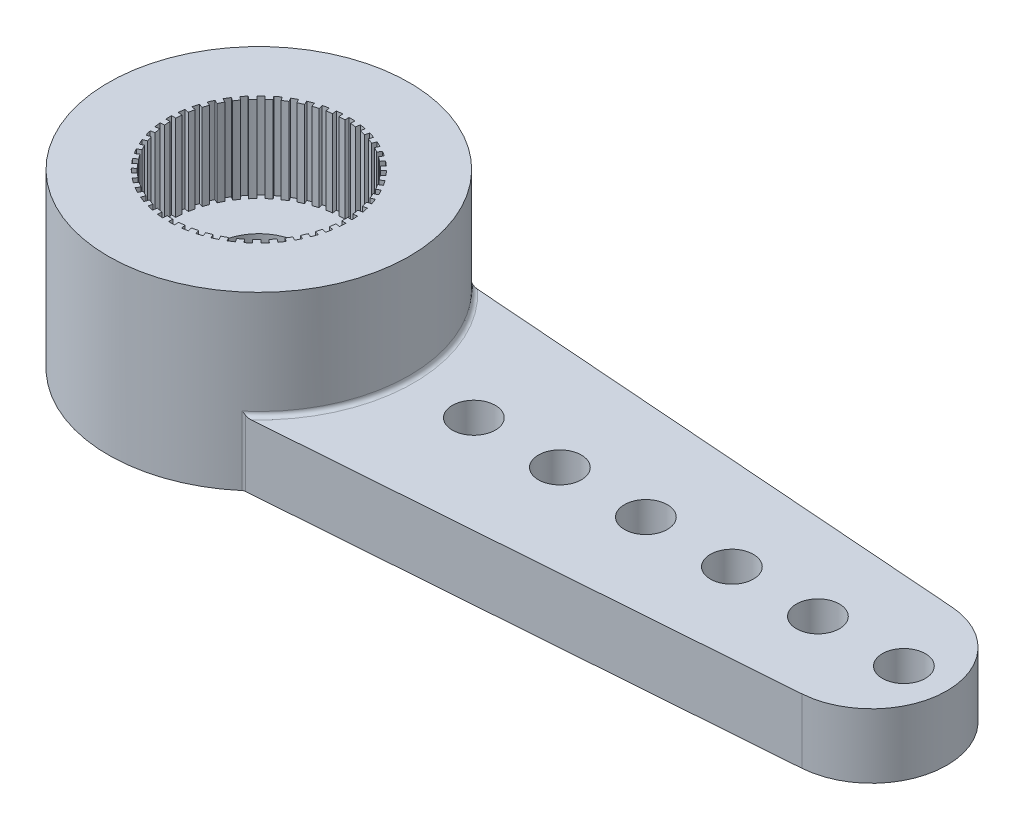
SolidWorks part; units mm, degrees
ref_plane "Front Plane" through (0, 0, 0) normal (0, 0, 1) x (1, 0, 0)
ref_plane "Top Plane" through (0, 0, 0) normal (0, 1, 0) x (1, 0, 0)
ref_plane "Right Plane" through (0, 0, 0) normal (1, 0, 0) x (0, 0, -1)
sketch "Sketch1" plane through (0, 0, 0) normal (0, 1, 0) x (1, 0, 0)
  line L0 (0.4179, 2.0559) -> (0.3984, 1.9599)
  line L1 (0.0709, 2.0967) -> (0, 0) construction
  line L2 (0.1402, 2.0933) -> (0.1336, 1.9955)
  line L3 (0.0016, 2.0979) -> (0.0015, 2)
  line L4 (0.2812, 2.079) -> (0.2681, 1.982)
  line L5 (0.6882, 1.9818) -> (0.6561, 1.8893)
  line L6 (0.5558, 2.023) -> (0.5298, 1.9285)
  line L7 (0.9462, 1.8724) -> (0.9021, 1.785)
  line L8 (0.8205, 1.9309) -> (0.7822, 1.8407)
  line L9 (1.1874, 1.7296) -> (1.1319, 1.6489)
  line L10 (1.0705, 1.8043) -> (1.0205, 1.72)
  line L11 (1.4073, 1.5559) -> (1.3416, 1.4833)
  line L12 (1.3014, 1.6455) -> (1.2407, 1.5687)
  line L13 (1.6021, 1.3544) -> (1.5273, 1.2912)
  line L14 (1.5091, 1.4573) -> (1.4387, 1.3893)
  line L15 (1.7684, 1.1288) -> (1.6858, 1.0761)
  line L16 (1.6899, 1.2432) -> (1.611, 1.1852)
  line L17 (1.9031, 0.883) -> (1.8142, 0.8418)
  line L18 (1.8405, 1.0069) -> (1.7546, 0.9598)
  line L19 (2.0038, 0.6215) -> (1.9102, 0.5925)
  line L20 (1.9583, 0.7526) -> (1.8669, 0.7174)
  line L21 (2.0687, 0.3489) -> (1.9721, 0.3326)
  line L22 (2.0412, 0.4848) -> (1.9459, 0.4622)
  line L23 (2.0968, 0.07) -> (1.9989, 0.0668)
  line L24 (2.0876, 0.2084) -> (1.9901, 0.1987)
  line L25 (2.0874, -0.2101) -> (1.9899, -0.2002)
  line L26 (2.0967, -0.0717) -> (1.9988, -0.0683)
  line L27 (2.0408, -0.4864) -> (1.9455, -0.4637)
  line L28 (2.0685, -0.3505) -> (1.9719, -0.3341)
  line L29 (1.9577, -0.7541) -> (1.8663, -0.7189)
  line L30 (2.0033, -0.6231) -> (1.9098, -0.594)
  line L31 (1.8398, -1.0083) -> (1.7539, -0.9612)
  line L32 (1.9024, -0.8845) -> (1.8136, -0.8432)
  line L33 (1.689, -1.2445) -> (1.6101, -1.1864)
  line L34 (1.7675, -1.1302) -> (1.685, -1.0774)
  line L35 (1.508, -1.4585) -> (1.4376, -1.3904)
  line L36 (1.6011, -1.3557) -> (1.5263, -1.2924)
  line L37 (1.3002, -1.6465) -> (1.2395, -1.5696)
  line L38 (1.4061, -1.557) -> (1.3405, -1.4843)
  line L39 (1.0691, -1.8051) -> (1.0192, -1.7208)
  line L40 (1.186, -1.7305) -> (1.1307, -1.6497)
  line L41 (0.819, -1.9315) -> (0.7807, -1.8413)
  line L42 (0.9448, -1.8732) -> (0.9007, -1.7857)
  line L43 (0.5542, -2.0234) -> (0.5283, -1.929)
  line L44 (0.6867, -1.9824) -> (0.6546, -1.8898)
  line L45 (0.2796, -2.0792) -> (0.2665, -1.9822)
  line L46 (0.4163, -2.0562) -> (0.3969, -1.9602)
  line L47 (-0.0001, -2.0979) -> (-0.0001, -2)
  line L48 (0.1386, -2.0934) -> (0.1321, -1.9956)
  line L49 (-0.2797, -2.0792) -> (-0.2666, -1.9821)
  line L50 (-0.1417, -2.0932) -> (-0.1351, -1.9954)
  line L51 (-0.5543, -2.0234) -> (-0.5284, -1.9289)
  line L52 (-0.4194, -2.0556) -> (-0.3998, -1.9596)
  line L53 (-0.8191, -1.9314) -> (-0.7808, -1.8413)
  line L54 (-0.6897, -1.9813) -> (-0.6575, -1.8888)
  line L55 (-1.0692, -1.805) -> (-1.0193, -1.7208)
  line L56 (-0.9476, -1.8717) -> (-0.9034, -1.7844)
  line L57 (-1.3002, -1.6464) -> (-1.2395, -1.5696)
  line L58 (-1.1886, -1.7287) -> (-1.1331, -1.648)
  line L59 (-1.5081, -1.4584) -> (-1.4377, -1.3903)
  line L60 (-1.4084, -1.5549) -> (-1.3427, -1.4823)
  line L61 (-1.689, -1.2444) -> (-1.6102, -1.1863)
  line L62 (-1.6031, -1.3533) -> (-1.5283, -1.2901)
  line L63 (-1.8398, -1.0082) -> (-1.7539, -0.9611)
  line L64 (-1.7692, -1.1275) -> (-1.6866, -1.0749)
  line L65 (-1.9578, -0.754) -> (-1.8664, -0.7188)
  line L66 (-1.9037, -0.8817) -> (-1.8148, -0.8405)
  line L67 (-2.0408, -0.4863) -> (-1.9455, -0.4636)
  line L68 (-2.0042, -0.6201) -> (-1.9106, -0.5911)
  line L69 (-2.0874, -0.2099) -> (-1.99, -0.2001)
  line L70 (-2.069, -0.3474) -> (-1.9724, -0.3312)
  line L71 (-2.0968, 0.0702) -> (-1.9989, 0.0669)
  line L72 (-2.0968, -0.0685) -> (-1.9989, -0.0653)
  line L73 (-2.0687, 0.349) -> (-1.9721, 0.3327)
  line L74 (-2.0873, 0.2116) -> (-1.9898, 0.2017)
  line L75 (-2.0037, 0.6216) -> (-1.9102, 0.5926)
  line L76 (-2.0404, 0.4879) -> (-1.9452, 0.4651)
  line L77 (-1.903, 0.8832) -> (-1.8142, 0.8419)
  line L78 (-1.9572, 0.7555) -> (-1.8658, 0.7202)
  line L79 (-1.7683, 1.1289) -> (-1.6858, 1.0762)
  line L80 (-1.839, 1.0096) -> (-1.7532, 0.9625)
  line L81 (-1.6021, 1.3545) -> (-1.5273, 1.2913)
  line L82 (-1.6881, 1.2457) -> (-1.6093, 1.1876)
  line L83 (-1.4072, 1.556) -> (-1.3415, 1.4833)
  line L84 (-1.507, 1.4596) -> (-1.4366, 1.3915)
  line L85 (-1.1873, 1.7297) -> (-1.1318, 1.6489)
  line L86 (-1.299, 1.6474) -> (-1.2383, 1.5705)
  line L87 (-0.9461, 1.8725) -> (-0.902, 1.7851)
  line L88 (-1.0678, 1.8059) -> (-1.0179, 1.7216)
  line L89 (-0.6881, 1.9819) -> (-0.656, 1.8894)
  line L90 (-0.8176, 1.9321) -> (-0.7794, 1.8419)
  line L91 (-0.4178, 2.0559) -> (-0.3983, 1.9599)
  line L92 (-0.5528, 2.0238) -> (-0.5269, 1.9293)
  line L93 (-0.1401, 2.0933) -> (-0.1335, 1.9955)
  line L94 (-0.2781, 2.0794) -> (-0.2651, 1.9824)
  circle A0 centre (0, 0) radius 3.5
  arc A1 (-1.0179, 1.7216) -> (-1.1318, 1.6489) centre (0, 0) ccw
  arc A2 (0.1402, 2.0933) -> (0.0016, 2.0979) centre (0, 0) ccw
  arc A3 (0.4179, 2.0559) -> (0.2812, 2.079) centre (0, 0) ccw
  arc A4 (0.6882, 1.9818) -> (0.5558, 2.023) centre (0, 0) ccw
  arc A5 (0.9462, 1.8724) -> (0.8205, 1.9309) centre (0, 0) ccw
  arc A6 (1.1874, 1.7296) -> (1.0705, 1.8043) centre (0, 0) ccw
  arc A7 (1.4073, 1.5559) -> (1.3014, 1.6455) centre (0, 0) ccw
  arc A8 (1.6021, 1.3544) -> (1.5091, 1.4573) centre (0, 0) ccw
  arc A9 (1.7684, 1.1288) -> (1.6899, 1.2432) centre (0, 0) ccw
  arc A10 (1.9031, 0.883) -> (1.8405, 1.0069) centre (0, 0) ccw
  arc A11 (2.0038, 0.6215) -> (1.9583, 0.7526) centre (0, 0) ccw
  arc A12 (2.0687, 0.3489) -> (2.0412, 0.4848) centre (0, 0) ccw
  arc A13 (2.0968, 0.07) -> (2.0876, 0.2084) centre (0, 0) ccw
  arc A14 (2.0874, -0.2101) -> (2.0967, -0.0717) centre (0, 0) ccw
  arc A15 (2.0408, -0.4864) -> (2.0685, -0.3505) centre (0, 0) ccw
  arc A16 (1.9577, -0.7541) -> (2.0033, -0.6231) centre (0, 0) ccw
  arc A17 (1.8398, -1.0083) -> (1.9024, -0.8845) centre (0, 0) ccw
  arc A18 (1.689, -1.2445) -> (1.7675, -1.1302) centre (0, 0) ccw
  arc A19 (1.508, -1.4585) -> (1.6011, -1.3557) centre (0, 0) ccw
  arc A20 (1.3002, -1.6465) -> (1.4061, -1.557) centre (0, 0) ccw
  arc A21 (1.0691, -1.8051) -> (1.186, -1.7305) centre (0, 0) ccw
  arc A22 (0.819, -1.9315) -> (0.9448, -1.8732) centre (0, 0) ccw
  arc A23 (0.5542, -2.0234) -> (0.6867, -1.9824) centre (0, 0) ccw
  arc A24 (0.2796, -2.0792) -> (0.4163, -2.0562) centre (0, 0) ccw
  arc A25 (-0.0001, -2.0979) -> (0.1386, -2.0934) centre (0, 0) ccw
  arc A26 (-0.2797, -2.0792) -> (-0.1417, -2.0932) centre (0, 0) ccw
  arc A27 (-0.5543, -2.0234) -> (-0.4194, -2.0556) centre (0, 0) ccw
  arc A28 (-0.8191, -1.9314) -> (-0.6897, -1.9813) centre (0, 0) ccw
  arc A29 (-1.0692, -1.805) -> (-0.9476, -1.8717) centre (0, 0) ccw
  arc A30 (-1.3002, -1.6464) -> (-1.1886, -1.7287) centre (0, 0) ccw
  arc A31 (-1.5081, -1.4584) -> (-1.4084, -1.5549) centre (0, 0) ccw
  arc A32 (-1.689, -1.2444) -> (-1.6031, -1.3533) centre (0, 0) ccw
  arc A33 (-1.8398, -1.0082) -> (-1.7692, -1.1275) centre (0, 0) ccw
  arc A34 (-1.9578, -0.754) -> (-1.9037, -0.8817) centre (0, 0) ccw
  arc A35 (-2.0408, -0.4863) -> (-2.0042, -0.6201) centre (0, 0) ccw
  arc A36 (-2.0874, -0.2099) -> (-2.069, -0.3474) centre (0, 0) ccw
  arc A37 (-2.0968, 0.0702) -> (-2.0968, -0.0685) centre (0, 0) ccw
  arc A38 (-2.0687, 0.349) -> (-2.0873, 0.2116) centre (0, 0) ccw
  arc A39 (-2.0037, 0.6216) -> (-2.0404, 0.4879) centre (0, 0) ccw
  arc A40 (-1.903, 0.8832) -> (-1.9572, 0.7555) centre (0, 0) ccw
  arc A41 (-1.7683, 1.1289) -> (-1.839, 1.0096) centre (0, 0) ccw
  arc A42 (-1.6021, 1.3545) -> (-1.6881, 1.2457) centre (0, 0) ccw
  arc A43 (-1.4072, 1.556) -> (-1.507, 1.4596) centre (0, 0) ccw
  arc A44 (-1.1873, 1.7297) -> (-1.299, 1.6474) centre (0, 0) ccw
  arc A45 (-0.9461, 1.8725) -> (-1.0678, 1.8059) centre (0, 0) ccw
  arc A46 (-0.6881, 1.9819) -> (-0.8176, 1.9321) centre (0, 0) ccw
  arc A47 (-0.4178, 2.0559) -> (-0.5528, 2.0238) centre (0, 0) ccw
  arc A48 (-0.1401, 2.0933) -> (-0.2781, 2.0794) centre (0, 0) ccw
  arc A49 (-1.2383, 1.5705) -> (-1.3415, 1.4833) centre (0, 0) ccw
  arc A50 (-1.4366, 1.3915) -> (-1.5273, 1.2913) centre (0, 0) ccw
  arc A51 (-1.6093, 1.1876) -> (-1.6858, 1.0762) centre (0, 0) ccw
  arc A52 (-1.7532, 0.9625) -> (-1.8142, 0.8419) centre (0, 0) ccw
  arc A53 (-1.8658, 0.7202) -> (-1.9102, 0.5926) centre (0, 0) ccw
  arc A54 (-1.9452, 0.4651) -> (-1.9721, 0.3327) centre (0, 0) ccw
  arc A55 (-1.9898, 0.2017) -> (-1.9989, 0.0669) centre (0, 0) ccw
  arc A56 (-1.9989, -0.0653) -> (-1.99, -0.2001) centre (0, 0) ccw
  arc A57 (-1.9724, -0.3312) -> (-1.9455, -0.4636) centre (0, 0) ccw
  arc A58 (-1.9106, -0.5911) -> (-1.8664, -0.7188) centre (0, 0) ccw
  arc A59 (-1.8148, -0.8405) -> (-1.7539, -0.9611) centre (0, 0) ccw
  arc A60 (-1.6866, -1.0749) -> (-1.6102, -1.1863) centre (0, 0) ccw
  arc A61 (-1.5283, -1.2901) -> (-1.4377, -1.3903) centre (0, 0) ccw
  arc A62 (-1.3427, -1.4823) -> (-1.2395, -1.5696) centre (0, 0) ccw
  arc A63 (-1.1331, -1.648) -> (-1.0193, -1.7208) centre (0, 0) ccw
  arc A64 (-0.9034, -1.7844) -> (-0.7808, -1.8413) centre (0, 0) ccw
  arc A65 (-0.6575, -1.8888) -> (-0.5284, -1.9289) centre (0, 0) ccw
  arc A66 (-0.3998, -1.9596) -> (-0.2666, -1.9821) centre (0, 0) ccw
  arc A67 (-0.1351, -1.9954) -> (-0.0001, -2) centre (0, 0) ccw
  arc A68 (0.1321, -1.9956) -> (0.2665, -1.9822) centre (0, 0) ccw
  arc A69 (0.3969, -1.9602) -> (0.5283, -1.929) centre (0, 0) ccw
  arc A70 (0.6546, -1.8898) -> (0.7807, -1.8413) centre (0, 0) ccw
  arc A71 (0.9007, -1.7857) -> (1.0192, -1.7208) centre (0, 0) ccw
  arc A72 (1.1307, -1.6497) -> (1.2395, -1.5696) centre (0, 0) ccw
  arc A73 (1.3405, -1.4843) -> (1.4376, -1.3904) centre (0, 0) ccw
  arc A74 (1.5263, -1.2924) -> (1.6101, -1.1864) centre (0, 0) ccw
  arc A75 (1.685, -1.0774) -> (1.7539, -0.9612) centre (0, 0) ccw
  arc A76 (1.8136, -0.8432) -> (1.8663, -0.7189) centre (0, 0) ccw
  arc A77 (1.9098, -0.594) -> (1.9455, -0.4637) centre (0, 0) ccw
  arc A78 (1.9719, -0.3341) -> (1.9899, -0.2002) centre (0, 0) ccw
  arc A79 (1.9988, -0.0683) -> (1.9989, 0.0668) centre (0, 0) ccw
  arc A80 (1.9901, 0.1987) -> (1.9721, 0.3326) centre (0, 0) ccw
  arc A81 (1.9459, 0.4622) -> (1.9102, 0.5925) centre (0, 0) ccw
  arc A82 (1.8669, 0.7174) -> (1.8142, 0.8418) centre (0, 0) ccw
  arc A83 (1.7546, 0.9598) -> (1.6858, 1.0761) centre (0, 0) ccw
  arc A84 (1.611, 1.1852) -> (1.5273, 1.2912) centre (0, 0) ccw
  arc A85 (1.4387, 1.3893) -> (1.3416, 1.4833) centre (0, 0) ccw
  arc A86 (1.2407, 1.5687) -> (1.1319, 1.6489) centre (0, 0) ccw
  arc A87 (1.0205, 1.72) -> (0.9021, 1.785) centre (0, 0) ccw
  arc A88 (0.7822, 1.8407) -> (0.6561, 1.8893) centre (0, 0) ccw
  arc A89 (0.5298, 1.9285) -> (0.3984, 1.9599) centre (0, 0) ccw
  arc A90 (0.2681, 1.982) -> (0.1336, 1.9955) centre (0, 0) ccw
  arc A91 (0.0015, 2) -> (-0.1335, 1.9955) centre (0, 0) ccw
  arc A92 (-0.2651, 1.9824) -> (-0.3983, 1.9599) centre (0, 0) ccw
  arc A93 (-0.5269, 1.9293) -> (-0.656, 1.8894) centre (0, 0) ccw
  arc A94 (-0.7794, 1.8419) -> (-0.902, 1.7851) centre (0, 0) ccw
  point P196 (0, 0)
  dimension "D1" = 7
  dimension "D2" = 4
  dimension "D3" = 47
  dimension "D4" = 0.0979
extrude "Boss-Extrude1" add sketch "Sketch1" along normal blind 4
sketch "Sketch2" plane through (0, 0, 0) normal (0, -1, 0) x (1, 0, 0)
  line L0 (0, 0) -> (14.25, 0) construction
  line L1 (0.9537, 2.7424) -> (14.3796, 1.7452)
  line L2 (16, 0) -> (14.25, 0) construction
  line L3 (0.9537, -2.7424) -> (14.3796, -1.7452)
  arc A0 (14.3796, -1.7452) -> (14.3796, 1.7452) centre (14.25, 0) ccw
  arc A1 (0.9537, -2.7424) -> (0.9537, 2.7424) centre (0.75, 0) ccw
  circle A2 centre (0, 0) radius 3.5 construction
  point P6 (-3.5, 0)
  point P7 (16, 0)
  point P10 (3.5, 0)
  dimension "D1" = 3.5
  dimension "D2" = 5.5
  dimension "D3" = 19.5
extrude "Boss-Extrude2" add sketch "Sketch2" against normal blind 1.5
sketch "Sketch3" plane through (0, 0, 0) normal (0, -1, 0) x (1, 0, 0)
  circle A0 centre (0, 0) radius 2.5
  circle A1 centre (0, 0) radius 1
  dimension "D1" = 5
  dimension "D2" = 2
extrude "Boss-Extrude3" add sketch "Sketch3" against normal blind 2
sketch "Sketch4" plane through (0, 0, 0) normal (0, -1, 0) x (1, 0, 0)
  circle A0 centre (0, 0) radius 2.5
  dimension "D1" = 5
extrude "Cut-Extrude1" cut sketch "Sketch4" against normal blind 1
sketch "Sketch5" plane through (0, 1.5, 0) normal (0, 1, 0) x (1, 0, 0)
  line L0 (-3.5, 0) -> (16, 0) construction
  circle A0 centre (0, 0) radius 3.5 construction
  arc A1 (14.3796, -1.7452) -> (14.3796, 1.7452) centre (14.25, 0) ccw construction
  circle A2 centre (15, 0) radius 0.5
  circle A3 centre (13, 0) radius 0.5
  circle A4 centre (11, 0) radius 0.5
  circle A5 centre (9, 0) radius 0.5
  circle A6 centre (7, 0) radius 0.5
  circle A7 centre (5, 0) radius 0.5
  point P9 (15.5, 0)
  dimension "D2" = 1
  dimension "D1" = 0.5
  dimension "D3" = 6
extrude "Cut-Extrude2" cut sketch "Sketch5" against normal blind 11
fillet "Fillet1" radius 0.1 3 edges at (2.2946, 0.75, -2.6428) (3.5, 1.5, 0) (2.2946, 0.75, 2.6428)
